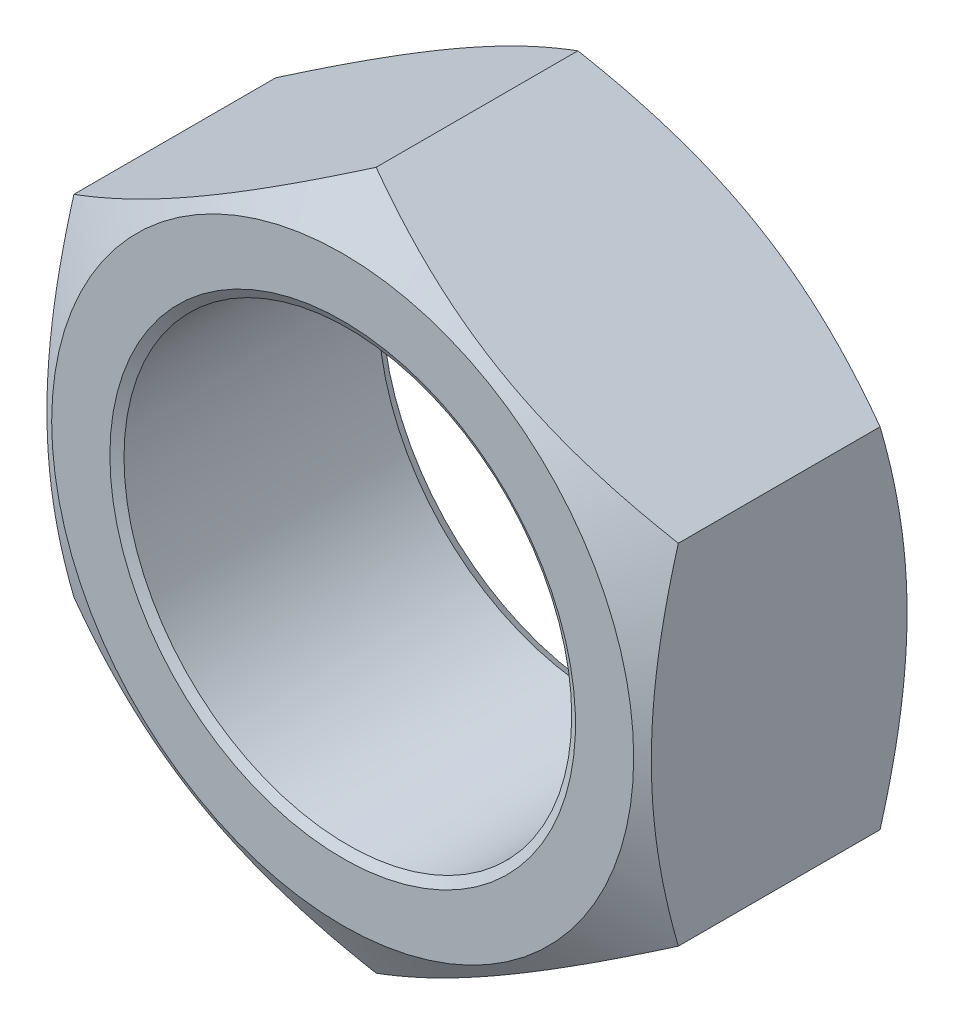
SolidWorks part; units mm, degrees
ref_plane "Front Plane" through (0, 0, 0) normal (0, 0, 1) x (1, 0, 0)
ref_plane "Top Plane" through (0, 0, 0) normal (0, 1, 0) x (1, 0, 0)
ref_plane "Right Plane" through (0, 0, 0) normal (1, 0, 0) x (0, 0, -1)
sketch "Sketch2" plane through (0, 0, 0) normal (0, 0, 1) x (1, 0, 0)
  line L1 (0, 19.7973) -> (-17.145, 9.8987)
  line L2 (-17.145, 9.8987) -> (-17.145, -9.8987)
  line L3 (-17.145, -9.8987) -> (0, -19.7973)
  line L4 (0, -19.7973) -> (17.145, -9.8987)
  line L5 (17.145, -9.8987) -> (17.145, 9.8987)
  line L6 (17.145, 9.8987) -> (0, 19.7973)
  circle A0 centre (0, 0) radius 17.145 construction
  circle A1 centre (0, 0) radius 12.7
  dimension "D1" = 34.29
  dimension "D2" = 25.4
extrude "Extrude1" add sketch "Sketch2" along normal mid plane 15.24
sketch "Sketch3" plane through (0, 0, 7.62) normal (0, 0, 1) x (1, 0, 0)
  circle A0 centre (0, 0) radius 16.51
  dimension "D1" = 33.02
extrude "Cut-Extrude1" cut sketch "Sketch3" against normal through all draft 60 flip side to cut
mirror "Mirror1" about plane through (0, 0, 0) normal (0, 0, 1) of "Cut-Extrude1"
chamfer "Chamfer1" distance 0.508 angle 30 2 edges at (12.7, 0, -7.62) (12.7, 0, 7.62)
